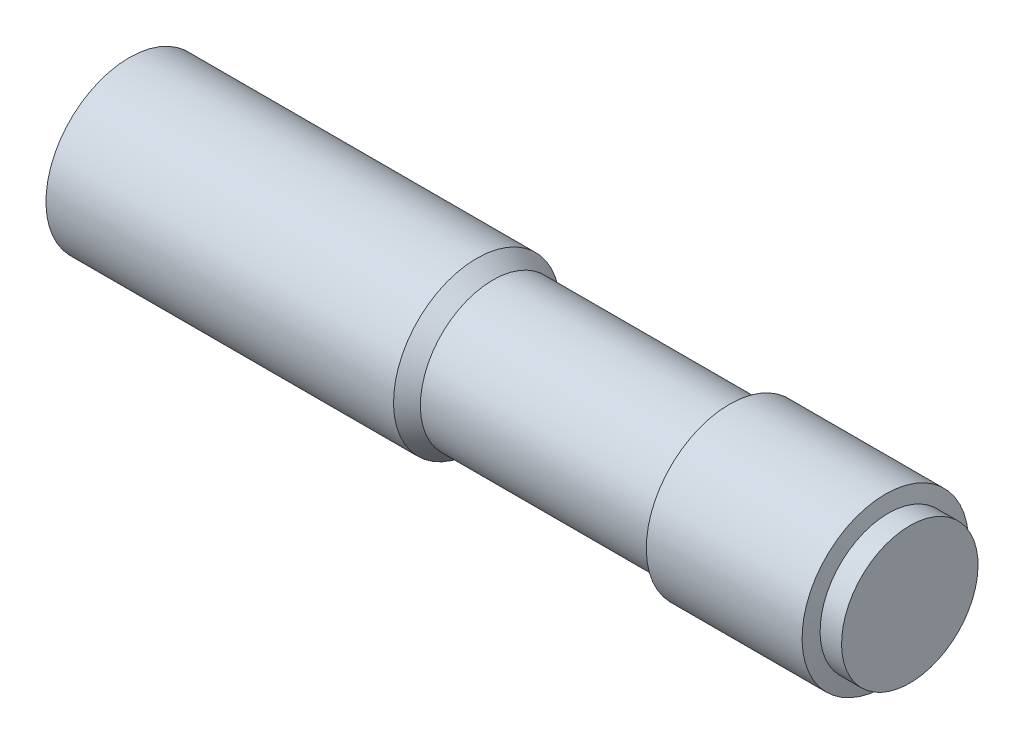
SolidWorks part; units mm, degrees
ref_plane "Front Plane" through (0, 0, 0) normal (0, 0, 1) x (1, 0, 0)
ref_plane "Top Plane" through (0, 0, 0) normal (0, 1, 0) x (1, 0, 0)
ref_plane "Right Plane" through (0, 0, 0) normal (1, 0, 0) x (0, 0, -1)
sketch "Sketch1" plane through (0, 0, 0) normal (0, 0, 1) x (1, 0, 0)
  line L0 (-72.9656, 5.2254) -> (-72.9656, 20.7254)
  line L1 (-72.9656, 20.7254) -> (-8.2656, 20.7254)
  line L2 (-8.2656, 20.7254) -> (-5.2729, 18.7254)
  line L3 (-5.2729, 18.7254) -> (37.4416, 18.7254)
  line L4 (37.4416, 18.7254) -> (38.7782, 20.7254)
  line L5 (38.7782, 20.7254) -> (67.7782, 20.7254)
  line L6 (67.7782, 20.7254) -> (68.3349, 17.9254)
  line L7 (68.3349, 17.9254) -> (72.3349, 17.9254)
  line L8 (72.3349, 17.9254) -> (72.3349, 5.2254)
  line L9 (72.3349, 5.2254) -> (-72.9656, 5.2254)
  dimension "D1" = 64.7
  dimension "D2" = 29
  dimension "D3" = 15.5
  dimension "D4" = 4
  dimension "D5" = 15.5
  dimension "D6" = 12.7
  dimension "D7" = 13.5
revolve "Revolve1" add sketch "Sketch1" angle 360 about L9
